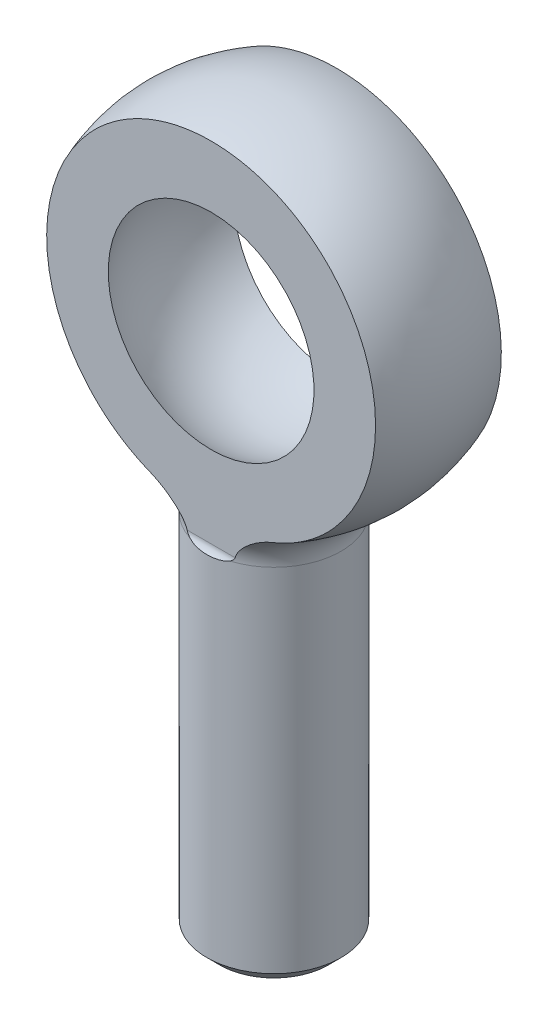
SolidWorks part; units mm, degrees
ref_plane "Face" through (0, 0, 0) normal (0, 0, 1) x (1, 0, 0)
ref_plane "Dessus" through (0, 0, 0) normal (0, 1, 0) x (1, 0, 0)
ref_plane "Droite" through (0, 0, 0) normal (1, 0, 0) x (0, 0, -1)
sketch "Esquisse1" plane through (0, 0, 0) normal (0, 0, 1) x (1, 0, 0)
  line L0 (0, 87.1004) -> (0, -122.1668) construction
  line L2 (0, -14.38) -> (0, -66)
  line L3 (0, -66) -> (-8, -66)
  line L4 (-8, -66) -> (-8, -22.5167)
  line L5 (0, 14.38) -> (0, 21)
  arc A0 (0, 21) -> (-10.5, -18.1865) centre (0, 0) ccw
  arc A1 (0, 14.38) -> (0, -14.38) centre (0, 0) ccw
  arc A2 (-8, -22.5167) -> (-10.5, -18.1865) centre (-13, -22.5167) ccw
  dimension "D1" = 42
  dimension "D2" = 28.76
  dimension "D5" = 5
  dimension "D3" = 8
  dimension "D4" = 66
revolve "Base-Révolution" add sketch "Esquisse1" angle 360 about L0
sketch "Esquisse2" plane through (0, 0, 0) normal (1, 0, 0) x (0, 0, -1)
  line L0 (47.5, 40) -> (7.5, 40)
  line L1 (7.5, 40) -> (7.5, -22)
  line L2 (8.5, -23) -> (47.5, -23)
  line L3 (47.5, -23) -> (47.5, 40)
  line L4 (-7.5, 40) -> (-7.5, -22)
  line L5 (-8.5, -23) -> (-47.5, -23)
  line L6 (-47.5, -23) -> (-47.5, 40)
  line L7 (-47.5, 40) -> (-7.5, 40)
  arc A0 (8.5, -23) -> (7.5, -22) centre (8.5, -22) cw
  arc A1 (-8.5, -23) -> (-7.5, -22) centre (-8.5, -22) ccw
  dimension "D9" = 1
  dimension "D1" = 23
  dimension "D2" = 23
  dimension "D3" = 40
  dimension "D4" = 40
  dimension "D5" = 7.5
  dimension "D6" = 7.5
  dimension "D7" = 40
  dimension "D8" = 40
extrude "Enlèv. mat.-Extru.1" cut sketch "Esquisse2" against normal through all and the other way through all
chamfer "Chanfrein1" distance 1.5 angle 45
